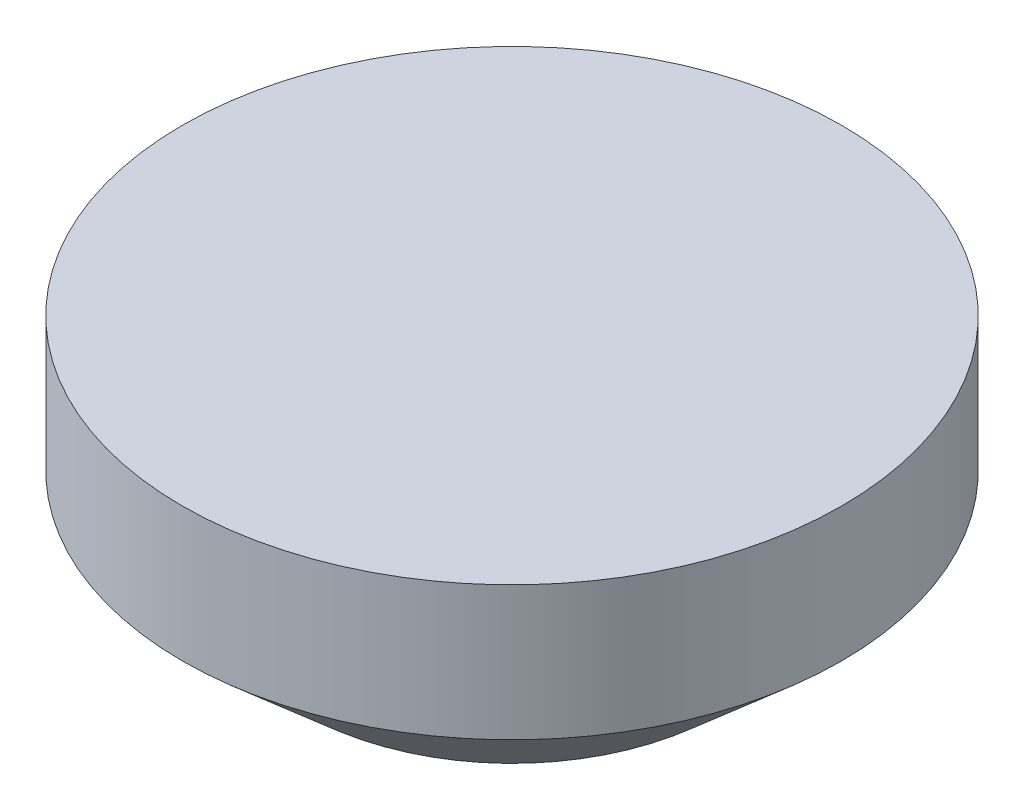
SolidWorks part; units mm, degrees
ref_plane "前视基准面" through (0, 0, 0) normal (0, 0, 1) x (1, 0, 0)
ref_plane "上视基准面" through (0, 0, 0) normal (0, 1, 0) x (1, 0, 0)
ref_plane "右视基准面" through (0, 0, 0) normal (1, 0, 0) x (0, 0, -1)
sketch "草图1" plane through (0, 0, 0) normal (0, 0, 1) x (1, 0, 0)
  line L0 (0, 0) -> (0, 1091.2106) construction
  line L1 (0, 410) -> (-565, 410)
  line L2 (-565, 410) -> (-565, 180)
  line L3 (-565, 180) -> (-360, 0)
  line L4 (-360, 0) -> (0, 0)
  line L5 (0, 0) -> (0, 410)
  dimension "D1" = 1130
  dimension "D2" = 720
  dimension "D3" = 230
  dimension "D4" = 180
revolve "旋转1" add sketch "草图1" angle 360 about L0
